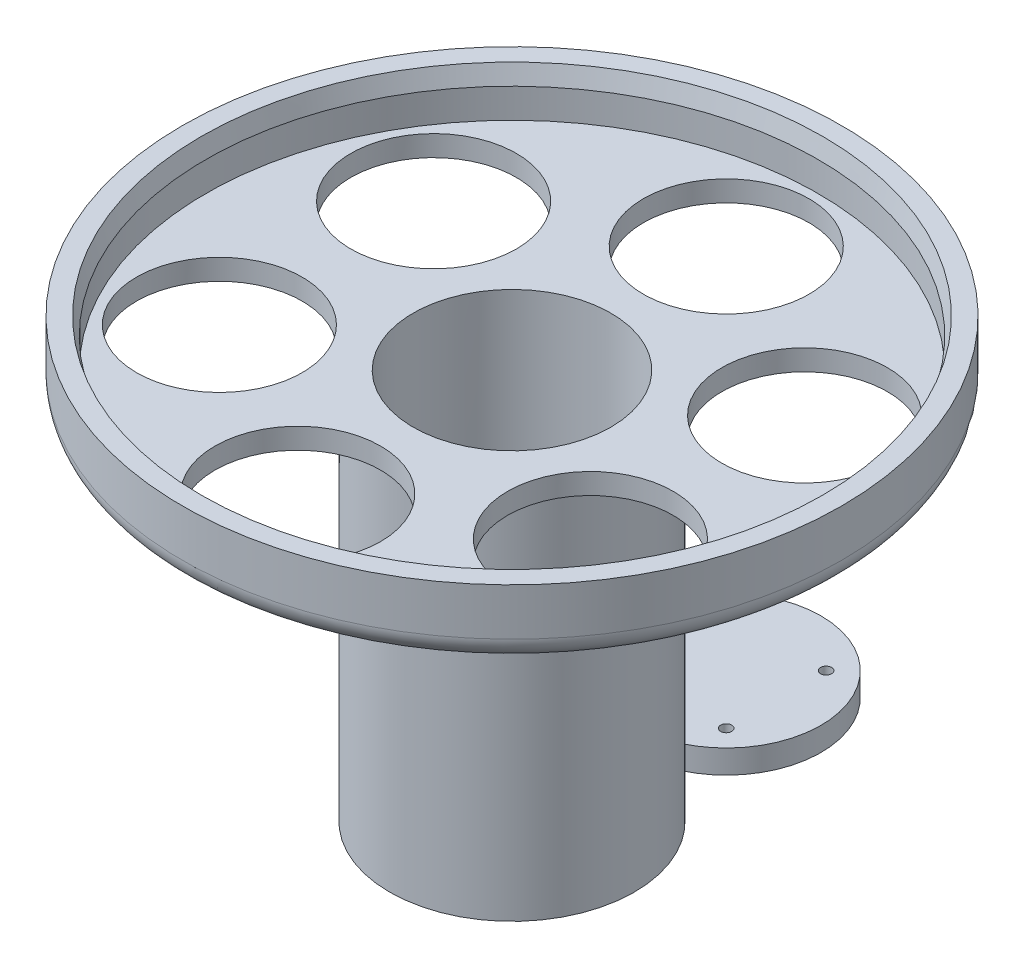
SolidWorks part; units mm, degrees
ref_plane "Front Plane" through (0, 0, 0) normal (0, 0, 1) x (1, 0, 0)
ref_plane "Top Plane" through (0, 0, 0) normal (0, 1, 0) x (1, 0, 0)
ref_plane "Right Plane" through (0, 0, 0) normal (1, 0, 0) x (0, 0, -1)
sketch "Sketch1" plane through (0, 0, 0) normal (0, 0, 1) x (1, 0, 0)
  line L0 (0, 0) -> (0, 32.6373) construction
  line L1 (0, 0) -> (-65, 0)
  line L2 (-65, 0) -> (-65, -10)
  line L3 (-65, -10) -> (-21, -10)
  line L4 (-21, -10) -> (-21, -93.02)
  line L5 (-21, -93.02) -> (0, -93.02)
  line L6 (0, -93.02) -> (0, 0)
  dimension "D1" = 21
  dimension "D2" = 10
  dimension "D3" = 44
  dimension "D4" = 83.02
revolve "Revolve1" add sketch "Sketch1" angle 360 about L0
shell "Shell1" thickness 5
chamfer "Chamfer2" distance 1 angle 75 1 edges at (65, 0, 0)
sketch "Sketch4" plane through (0, -10, 0) normal (0, 1, 0) x (1, 0, 0)
  line L0 (0, 26) -> (0, 65) construction
  circle A1 centre (0, 0) radius 65 construction
  circle A2 centre (0, 0) radius 45.5 construction
  circle A3 centre (0, 45.5) radius 17.59
  circle A6 centre (0, 0) radius 26 construction
  point P10 (0, 45.5)
  dimension "D1" = 35.18
extrude "Cut-Extrude1" cut sketch "Sketch4" against normal up to surface (5 mm away)
pattern_circular "CirPattern1" count 6 over 360 about axis through (0, 0, 0) along (0, 1, 0) of "Cut-Extrude1"
chamfer "Chamfer3" distance 1 angle 30 6 edges at (-17.59, -15, -45.5) (-17.59, -15, 45.5) (21.8142, -15, 22.75) (21.8142, -15, -22.75) (-56.9942, -15, 22.75) (-56.9942, -15, -22.75)
fillet "Fillet1" radius 5 1 edges at (-70, -15, 0)
fillet "Fillet2" radius 0.5 1 edges at (-26, -15, 0)
ref_plane "Plane1" through (0, -93.02, 0) normal (0, -1, 0) x (-1, 0, 0)
sketch "Sketch5" plane through (0, -93.02, 0) normal (0, -1, 0) x (-1, 0, 0)
  circle A0 centre (0, 45.5) radius 20.14
  circle A1 centre (0, 45.5) radius 20.14
  circle A2 centre (0, 45.5) radius 18.59 construction
  dimension "D1" = 40.28
sketch "Sketch6" plane through (0, -93.02, 0) normal (0, -1, 0) x (1, 0, 0)
  circle A1 centre (0, 0) radius 21
  circle A2 centre (0, 0) radius 21 construction
extrude "Boss-Extrude1" add sketch "Sketch5" against normal blind 5 contours A0
chamfer "Chamfer1" distance 2.5 angle 75 1 edges at (21, -93.02, 0)
sketch "Sketch9" plane through (0, -88.02, 0) normal (0, 1, 0) x (1, 0, 0)
  circle A0 centre (0, 45.5) radius 20.14
  arc A1 (3.7973, 25.7212) -> (-3.7973, 25.7212) centre (0, 45.5) ccw construction
extrude "Cut-Extrude4" cut sketch "Sketch9" along normal up to surface (73.02 mm away)
sketch "Sketch10" plane through (0, -93.02, 0) normal (0, -1, 0) x (1, 0, 0)
  line L1 (-10.6066, -56.1066) -> (10.6066, -56.1066) construction
  line L2 (-10.6066, -56.1066) -> (-10.6066, -34.8934) construction
  line L3 (-10.6066, -34.8934) -> (10.6066, -34.8934) construction
  line L4 (10.6066, -56.1066) -> (10.6066, -34.8934) construction
  line L5 (-10.6066, -56.1066) -> (10.6066, -34.8934) construction
  line L6 (-10.6066, -34.8934) -> (10.6066, -56.1066) construction
  circle A0 centre (0, -45.5) radius 15 construction
  dimension "D1" = 30
hole_wizard "Ø1.0mm Dowel Hole1" positions "Sketch11" profile "Sketch12" hole size "Ø1.0" standard "ANSI Metric"
sketch "Sketch11" plane through (0, -93.02, 0) normal (0, -1, 0) x (-1, 0, 0)
  point P0 (-10.6066, 56.1066)
  point P3 (10.6066, 56.1066)
  point P6 (10.6066, 34.8934)
  point P9 (-10.6066, 34.8934)
sketch "Sketch12" plane through (10.6066, -93.02, -56.1066) normal (1, 0, 0) x (0, 0, -1)
  line L0 (0, 0) -> (0, 5)
  line L1 (0, 5) -> (1.175, 5)
  line L2 (1.175, 5) -> (1.175, 0)
  line L5 (1.175, 0) -> (0, 0)
  line L11 (0, -6.35) -> (0, 107.95) construction
  dimension "Thru Hole Dia." = 2.35
  dimension "Thru Hole Depth" = 5
